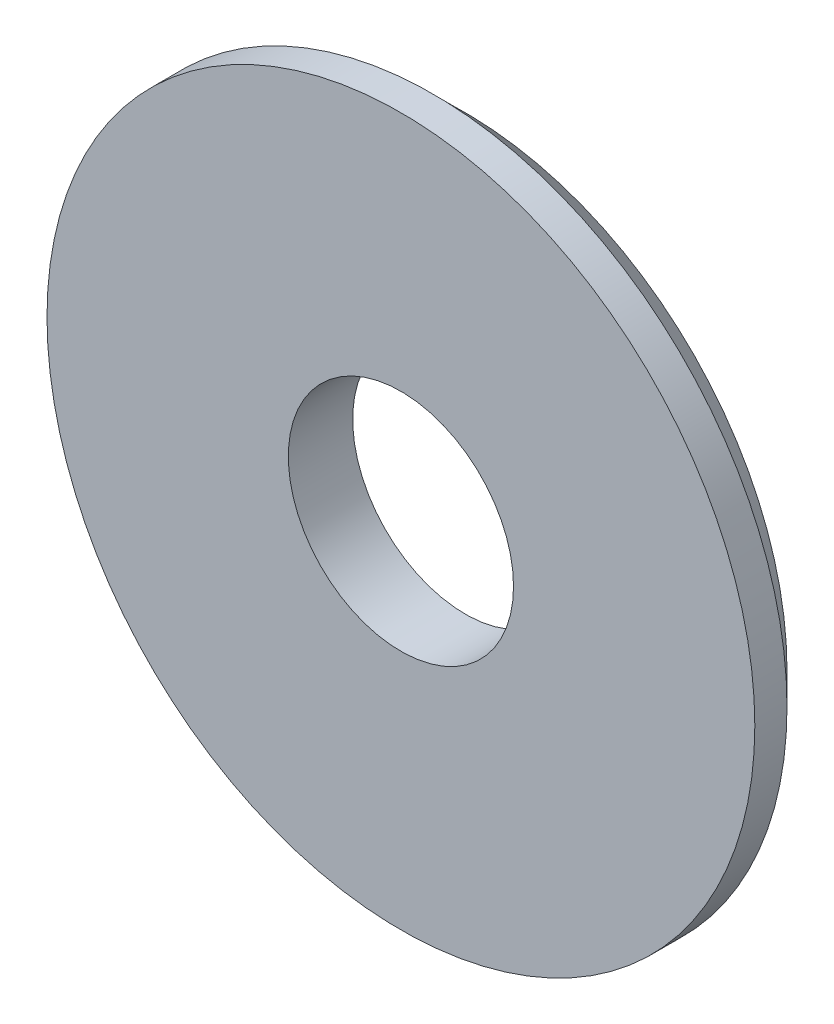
SolidWorks part; units mm, degrees
ref_plane "Plan1" through (0, 0, 0) normal (0, 0, 1) x (1, 0, 0)
ref_plane "Plan2" through (0, 0, 0) normal (0, 1, 0) x (1, 0, 0)
ref_plane "Plan3" through (0, 0, 0) normal (1, 0, 0) x (0, 0, -1)
sketch "Esquisse1" plane through (0, 0, 0) normal (0, 0, 1) x (1, 0, 0)
  circle A0 centre (0, 0) radius 11
  circle A1 centre (0, 0) radius 3.5
  dimension "D1" = 7
  dimension "D2" = 22
extrude "Base-Extrusion" add sketch "Esquisse1" along normal blind 2
chamfer "Chanfrein1" distance 1 angle 45
